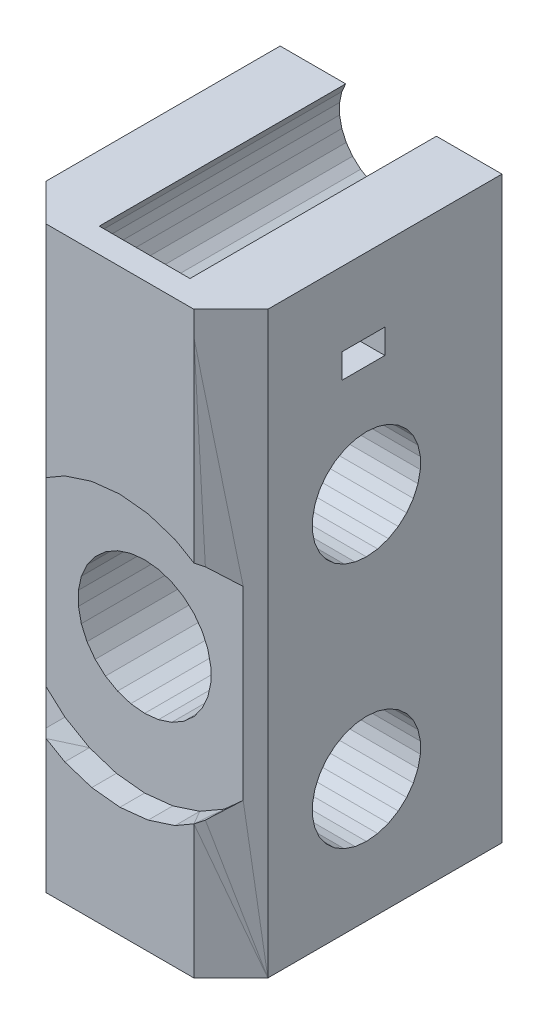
SolidWorks part; units mm, degrees
ref_plane "Alzado" through (0, 0, 0) normal (0, 0, 1) x (1, 0, 0)
ref_plane "Planta" through (0, 0, 0) normal (0, 1, 0) x (1, 0, 0)
ref_plane "Vista lateral" through (0, 0, 0) normal (1, 0, 0) x (0, 0, -1)
imported_body "Sólido importado3"
sketch "Croquis1" plane through (0, 34.9445, 0) normal (0, 1, 0) x (-1, 0, 0)
  line L0 (20.5586, 9.5) -> (20.5586, 13)
  line L1 (20.5586, 13) -> (2.5586, 13)
  line L2 (2.5586, 13) -> (2.5586, 9.5)
  line L3 (2.5586, 9.5) -> (20.5586, 9.5)
extrude "Cortar-Extruir1" cut sketch "Croquis1" against normal blind 1.8
sketch "Croquis2" plane through (-20.5586, 0, 0) normal (-1, 0, 0) x (0, 0, 1)
  line L0 (12.7896, 28.1641) -> (11.9148, 28.4483)
  line L1 (11.9148, 28.4483) -> (11, 28.5445)
  line L2 (11, 28.5445) -> (10.0852, 28.4483)
  line L3 (10.0852, 28.4483) -> (9.2104, 28.1641)
  line L4 (9.2104, 28.1641) -> (8.4137, 27.7042)
  line L5 (8.4137, 27.7042) -> (7.7302, 27.0887)
  line L6 (7.7302, 27.0887) -> (7.1895, 26.3445)
  line L7 (7.1895, 26.3445) -> (6.8154, 25.5042)
  line L8 (6.8154, 25.5042) -> (6.6241, 24.6044)
  line L9 (6.6241, 24.6044) -> (6.6241, 23.6846)
  line L10 (6.6241, 23.6846) -> (6.8154, 22.7848)
  line L11 (6.8154, 22.7848) -> (7.1895, 21.9445)
  line L12 (7.1895, 21.9445) -> (7.7302, 21.2003)
  line L13 (7.7302, 21.2003) -> (8.4137, 20.5848)
  line L14 (8.4137, 20.5848) -> (9.2104, 20.1249)
  line L15 (9.2104, 20.1249) -> (10.0852, 19.8407)
  line L16 (10.0852, 19.8407) -> (11, 19.7445)
  line L17 (11, 19.7445) -> (11.9148, 19.8407)
  line L18 (11.9148, 19.8407) -> (12.7896, 20.1249)
  line L19 (12.7896, 20.1249) -> (13.5863, 20.5848)
  line L20 (13.5863, 20.5848) -> (14.2698, 21.2003)
  line L21 (14.2698, 21.2003) -> (14.8105, 21.9445)
  line L22 (14.8105, 21.9445) -> (15.1846, 22.7848)
  line L23 (15.1846, 22.7848) -> (15.3759, 23.6846)
  line L24 (15.3759, 23.6846) -> (15.3759, 24.6044)
  line L25 (15.3759, 24.6044) -> (15.1846, 25.5042)
  line L26 (15.1846, 25.5042) -> (14.8105, 26.3445)
  line L27 (14.8105, 26.3445) -> (14.2698, 27.0887)
  line L28 (14.2698, 27.0887) -> (13.5863, 27.7042)
  line L29 (13.5863, 27.7042) -> (12.7896, 28.1641)
extrude "Cortar-Extruir2" cut sketch "Croquis2" against normal through all
